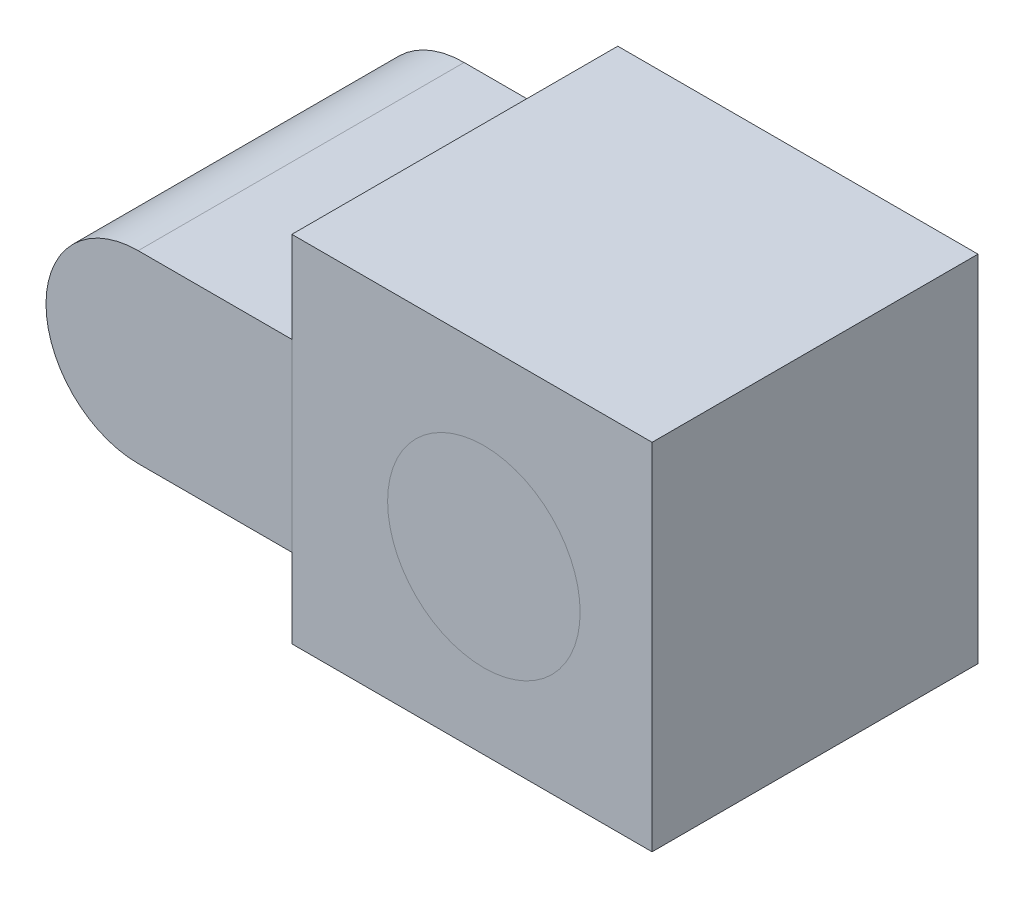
SolidWorks part; units mm, degrees
ref_plane "Front Plane" through (0, 0, 0) normal (0, 0, 1) x (1, 0, 0)
ref_plane "Top Plane" through (0, 0, 0) normal (0, 1, 0) x (1, 0, 0)
ref_plane "Right Plane" through (0, 0, 0) normal (1, 0, 0) x (0, 0, -1)
sketch "Sketch2" plane through (0, 0, 0) normal (0, 0, 1) x (1, 0, 0)
  line L0 (0, 52.6131) -> (-30.6603, 52.6131)
  line L1 (0, 0) -> (71.8678, 0)
  line L2 (0, 0) -> (0, 15.8207)
  line L3 (0, 70.7641) -> (71.8678, 70.7641)
  line L4 (71.8678, 0) -> (71.8678, 70.7641)
  line L5 (-30.6603, 15.8207) -> (0, 15.8207)
  line L6 (0, 52.6131) -> (0, 70.7641)
  arc A0 (-30.6603, 52.6131) -> (-30.6603, 15.8207) centre (-30.6603, 34.2169) ccw
extrude "Extrude1" add sketch "Sketch2" along normal blind 65.024
sketch "Sketch3" plane through (0, 0, 65.024) normal (0, 0, 1) x (1, 0, 0)
  circle A0 centre (38.3062, 34.2169) radius 19.2044
split "Split3" trim tools "Sketch3" bodies to split 101 resulting bodies 108 109 110
